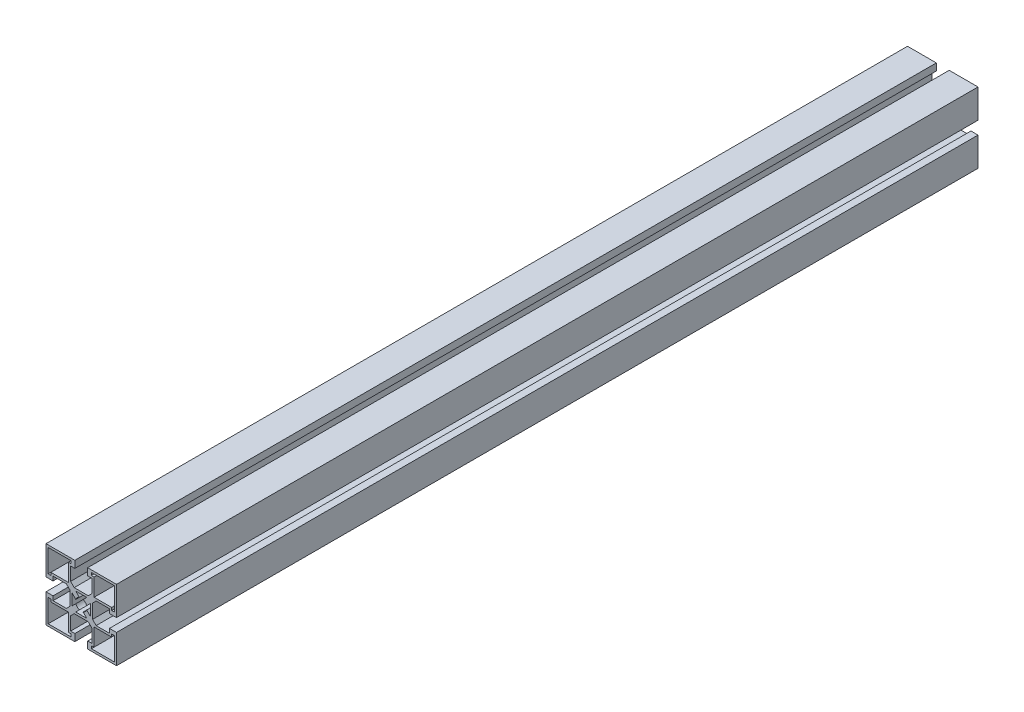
SolidWorks part; units mm, degrees
ref_plane "Front Plane" through (0, 0, 0) normal (0, 0, 1) x (1, 0, 0)
ref_plane "Top Plane" through (0, 0, 0) normal (0, 1, 0) x (1, 0, 0)
ref_plane "Right Plane" through (0, 0, 0) normal (1, 0, 0) x (0, 0, -1)
sketch "Sketch1" plane through (0, 0, 0) normal (0, 0, 1) x (1, 0, 0)
  line L18 (8.2, 8.2) -> (8.2, 19.4)
  line L20 (19.4, 8.2) -> (8.2, 8.2)
  line L21 (19.4, 6.5) -> (19.4, 8.2)
  line L22 (21.1, 6.5) -> (19.4, 6.5)
  line L23 (21.1, 21.1) -> (21.1, 6.5)
  line L24 (6.5, 21.1) -> (21.1, 21.1)
  line L25 (6.5, 19.4) -> (6.5, 21.1)
  line L26 (8.2, 19.4) -> (6.5, 19.4)
  line L27 (-19.4, 6.5) -> (-21.1, 6.5)
  line L28 (-19.4, 8.2) -> (-19.4, 6.5)
  line L29 (-8.2, 8.2) -> (-19.4, 8.2)
  line L31 (-8.2, 19.4) -> (-8.2, 8.2)
  line L32 (-6.5, 19.4) -> (-8.2, 19.4)
  line L33 (-6.5, 21.1) -> (-6.5, 19.4)
  line L34 (-21.1, 21.1) -> (-6.5, 21.1)
  line L35 (-21.1, 6.5) -> (-21.1, 21.1)
  line L88 (-22.5, -22.5) -> (-4.1, -22.5)
  line L89 (-4.1, -22.5) -> (-4.1, -18)
  line L90 (-4.1, -18) -> (-6.8, -18)
  line L91 (-6.8, -18) -> (-6.8, -9.5)
  line L92 (-6.8, -9.5) -> (-4.5, -7.2)
  line L93 (-4.5, -7.2) -> (4.5, -7.2)
  line L94 (4.5, -7.2) -> (6.8, -9.5)
  line L95 (6.8, -9.5) -> (6.8, -18)
  line L96 (6.8, -18) -> (4.1, -18)
  line L97 (4.1, -18) -> (4.1, -22.5)
  line L98 (4.1, -22.5) -> (22.5, -22.5)
  line L99 (22.5, -22.5) -> (22.5, -4.1)
  line L100 (22.5, -4.1) -> (18, -4.1)
  line L101 (18, -4.1) -> (18, -6.8)
  line L102 (18, -6.8) -> (9.5, -6.8)
  line L103 (9.5, -6.8) -> (7.2, -4.5)
  line L104 (7.2, -4.5) -> (7.2, 4.5)
  line L105 (7.2, 4.5) -> (9.5, 6.8)
  line L106 (9.5, 6.8) -> (18, 6.8)
  line L107 (18, 6.8) -> (18, 4.1)
  line L108 (18, 4.1) -> (22.5, 4.1)
  line L109 (22.5, 4.1) -> (22.5, 22.5)
  line L110 (22.5, 22.5) -> (4.1, 22.5)
  line L111 (4.1, 22.5) -> (4.1, 18)
  line L112 (4.1, 18) -> (6.8, 18)
  line L113 (6.8, 18) -> (6.8, 9.5)
  line L114 (6.8, 9.5) -> (4.5, 7.2)
  line L115 (4.5, 7.2) -> (-4.5, 7.2)
  line L116 (-4.5, 7.2) -> (-6.8, 9.5)
  line L117 (-6.8, 9.5) -> (-6.8, 18)
  line L118 (-6.8, 18) -> (-4.1, 18)
  line L119 (-4.1, 18) -> (-4.1, 22.5)
  line L120 (-4.1, 22.5) -> (-22.5, 22.5)
  line L121 (-22.5, 22.5) -> (-22.5, 4.1)
  line L122 (-22.5, 4.1) -> (-18, 4.1)
  line L123 (-18, 4.1) -> (-18, 6.8)
  line L124 (-18, 6.8) -> (-9.5, 6.8)
  line L125 (-9.5, 6.8) -> (-7.2, 4.5)
  line L126 (-7.2, 4.5) -> (-7.2, -4.5)
  line L127 (-7.2, -4.5) -> (-9.5, -6.8)
  line L128 (-9.5, -6.8) -> (-18, -6.8)
  line L129 (-18, -6.8) -> (-18, -4.1)
  line L130 (-18, -4.1) -> (-22.5, -4.1)
  line L131 (-22.5, -4.1) -> (-22.5, -22.5)
  line L133 (-6.5, -21.1) -> (-21.1, -21.1)
  line L134 (-6.5, -19.4) -> (-6.5, -21.1)
  line L135 (-8.2, -19.4) -> (-6.5, -19.4)
  line L136 (-8.2, -8.2) -> (-8.2, -19.4)
  line L138 (-19.4, -8.2) -> (-8.2, -8.2)
  line L139 (-19.4, -6.5) -> (-19.4, -8.2)
  line L140 (-21.1, -6.5) -> (-19.4, -6.5)
  line L141 (-21.1, -21.1) -> (-21.1, -6.5)
  line L151 (6.5, -19.4) -> (8.2, -19.4)
  line L152 (6.5, -21.1) -> (6.5, -19.4)
  line L153 (21.1, -21.1) -> (6.5, -21.1)
  line L154 (21.1, -6.5) -> (21.1, -21.1)
  line L155 (19.4, -6.5) -> (21.1, -6.5)
  line L156 (19.4, -8.2) -> (19.4, -6.5)
  line L157 (8.2, -8.2) -> (19.4, -8.2)
  line L159 (8.2, -19.4) -> (8.2, -8.2)
  line L172 (-5.8, 3.5373) -> (-3.4511, 1.1884)
  line L173 (-5.8, -3.5373) -> (-5.8, 3.5373)
  line L174 (-3.4511, -1.1884) -> (-5.8, -3.5373)
  line L175 (-3.5373, -5.8) -> (-1.1884, -3.4511)
  line L176 (3.5373, -5.8) -> (-3.5373, -5.8)
  line L177 (1.1884, -3.4511) -> (3.5373, -5.8)
  line L178 (5.8, -3.5373) -> (3.4511, -1.1884)
  line L179 (5.8, 3.5373) -> (5.8, -3.5373)
  line L180 (3.4511, 1.1884) -> (5.8, 3.5373)
  line L181 (3.5373, 5.8) -> (1.1884, 3.4511)
  line L182 (-3.5373, 5.8) -> (3.5373, 5.8)
  line L183 (-1.1884, 3.4511) -> (-3.5373, 5.8)
  arc A4 (-1.1884, 3.4511) -> (-3.4511, 1.1884) centre (0, 0) ccw
  arc A5 (-3.4511, -1.1884) -> (-1.1884, -3.4511) centre (0, 0) ccw
  arc A6 (1.1884, -3.4511) -> (3.4511, -1.1884) centre (0, 0) ccw
  arc A7 (3.4511, 1.1884) -> (1.1884, 3.4511) centre (0, 0) ccw
extrude "Extrude1" add sketch "Sketch1" along normal blind 550
